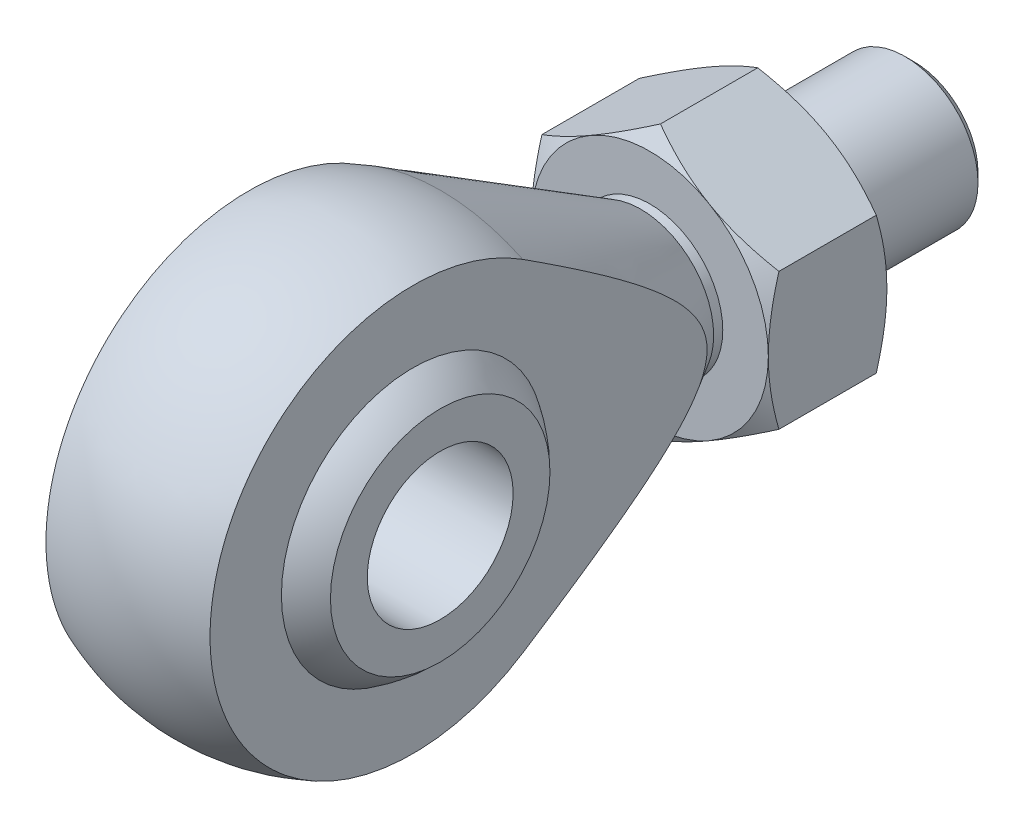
SolidWorks part; units mm, degrees
ref_plane "Face" through (0, 0, 0) normal (0, 0, 1) x (1, 0, 0)
ref_plane "Dessus" through (0, 0, 0) normal (0, 1, 0) x (1, 0, 0)
ref_plane "Droite" through (0, 0, 0) normal (1, 0, 0) x (0, 0, -1)
sketch "Esquisse1" plane through (0, 0, 0) normal (1, 0, 0) x (0, 0, -1)
  line L0 (0, 0) -> (123.9817, 0) construction
  line L1 (-12, 0) -> (32, 0)
  line L2 (32, 0) -> (32, 4)
  line L3 (32, 4) -> (17, 4)
  line L4 (17, 4) -> (6.0293, 10.3753)
  arc A0 (6.0293, 10.3753) -> (-12, 0) centre (0, 0) ccw
  dimension "D1" = 24
  dimension "D2" = 8
  dimension "D3" = 44
  dimension "D4" = 15
revolve "Révolution1" add sketch "Esquisse1" angle 360 about L0
sketch "Esquisse2" plane through (0, 0, 0) normal (0, 1, 0) x (1, 0, 0)
  line L0 (0, 0) -> (0, 38.6921) construction
  line L2 (-14.5, 35) -> (-4.5, 35)
  line L3 (-14.5, 35) -> (-14.5, -15)
  line L4 (-14.5, -15) -> (-4.5, -15)
  line L5 (-4.5, 35) -> (-4.5, -15)
  line L6 (4.5, 35) -> (14.5, 35)
  line L7 (4.5, 35) -> (4.5, -15)
  line L8 (4.5, -15) -> (14.5, -15)
  line L9 (14.5, 35) -> (14.5, -15)
  dimension "D1" = 9
  dimension "D2" = 10
  dimension "D3" = 35
  dimension "D4" = 50
extrude "Enlèv. mat.-Extru.1" cut sketch "Esquisse2" against normal through all and the other way through all
sketch "Esquisse3" plane through (0, 0, 0) normal (1, 0, 0) x (0, 0, -1)
  line L0 (0, 0) -> (7.6706, 0) construction
  line L1 (-8.5, 0) -> (8.5, 0)
  arc A0 (8.5, 0) -> (-8.5, 0) centre (0, 0) ccw
  dimension "D1" = 8.5
revolve "Révolution2" add sketch "Esquisse3" angle 360 about L0
sketch "Esquisse4" plane through (0, 0, 0) normal (0, 1, 0) x (1, 0, 0)
  line L0 (0, 0) -> (0, 15) construction
  line L2 (-11, 7.5) -> (-6, 7.5)
  line L3 (-11, 7.5) -> (-11, -7.5)
  line L4 (-11, -7.5) -> (-6, -7.5)
  line L5 (-6, 7.5) -> (-6, -7.5)
  line L6 (6, 7.5) -> (11, 7.5)
  line L7 (6, 7.5) -> (6, -7.5)
  line L8 (6, -7.5) -> (11, -7.5)
  line L9 (11, 7.5) -> (11, -7.5)
  dimension "D1" = 12
  dimension "D2" = 15
  dimension "D3" = 5
  dimension "D4" = 7.5
extrude "Enlèv. mat.-Extru.2" cut sketch "Esquisse4" against normal through all and the other way through all
other "Perçage1"
sketch "Esquisse6" plane through (6, 0, 0) normal (1, 0, 0) x (0, 0, -1)
  circle A0 centre (0, 0) radius 4
  dimension "D1" = 8
chamfer "Chanfrein1" distance 0.5 angle 45 1 edges at (4, 0, -32)
inserted part "ECROU H M8"
move or copy body "Corps-Déplacer/Copier2" placed by mates yes
other "Distance2" parameters "D1"=8
other "<ECROU H M8>-<Enlèv. mat.-Extru.1>"
